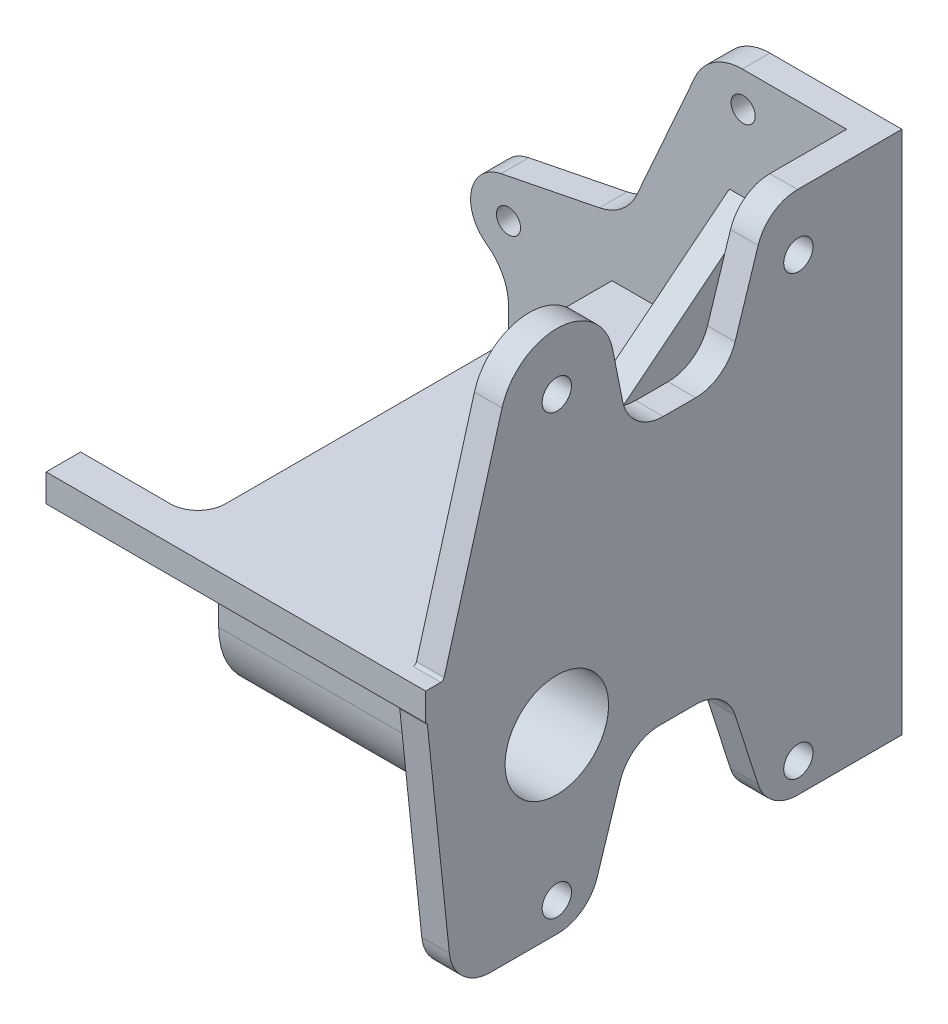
SolidWorks part; units mm, degrees
ref_plane "Plan1" through (0, 0, 0) normal (0, 0, 1) x (1, 0, 0)
ref_plane "Plan2" through (0, 0, 0) normal (0, 1, 0) x (1, 0, 0)
ref_plane "Plan3" through (0, 0, 0) normal (1, 0, 0) x (0, 0, -1)
sketch "Esquisse1" plane through (0, 0, 0) normal (0, 0, 1) x (1, 0, 0)
  line L0 (106, 72) -> (106, -80)
  line L1 (106, 72) -> (58, 72)
  line L2 (106, -80) -> (0, -80)
  line L3 (58, 72) -> (34, 18)
  line L4 (34, 18) -> (-2.1522, 10.7874)
  line L5 (0, -11) -> (0, -80)
  arc A0 (-2.1522, 10.7874) -> (0, -11) centre (0, 0) ccw
  dimension "D7" = 11
  dimension "D1" = 72
  dimension "D2" = 80
  dimension "D3" = 106
  dimension "D4" = 48
  dimension "D5" = 72
  dimension "D6" = 54
extrude "Base-Extrusion" add sketch "Esquisse1" along normal blind 8
fillet "Congé1" radius 15
sketch "Esquisse2" plane through (106, 0, 0) normal (1, 0, 0) x (0, 0, -1)
  line L0 (0, 72) -> (0, -80)
  line L1 (0, -80) -> (-39, -80)
  line L2 (0, 72) -> (-39, 72)
  line L3 (-39, 72) -> (-51, 34.5)
  line L4 (-39, -80) -> (-51, -42.5)
  line L5 (-138, -4) -> (0, -4) construction
  line L6 (-51, -42.5) -> (-79, -42.5)
  line L7 (-79, -42.5) -> (-91, -80)
  line L8 (-91, -80) -> (-130, -80)
  line L9 (-130, -80) -> (-138, -4)
  line L10 (-51, 34.5) -> (-79, 34.5)
  line L11 (-79, 34.5) -> (-83.817, 58.7187)
  line L12 (-115.8756, 59.9961) -> (-134, -4)
  line L13 (-138, -4) -> (-134, -4)
  arc A0 (-83.817, 58.7187) -> (-115.8756, 59.9961) centre (-100, 55.5) ccw
  dimension "D1" = 39
  dimension "D2" = 37.5
  dimension "D3" = 51
  dimension "D4" = 28
  dimension "D5" = 91
  dimension "D6" = 138
  dimension "D7" = 130
  dimension "D8" = 59.5
  dimension "D9" = 100
  dimension "D10" = 4
extrude "Boss.-Extru.1" add sketch "Esquisse2" against normal blind 8
fillet "Congé2" radius 12
sketch "Esquisse3" plane through (106, 0, 0) normal (1, 0, 0) x (0, 0, -1)
  line L0 (0, -80) -> (0, 72) construction
  line L1 (-138, 0) -> (0, 0)
  line L2 (-138, 0) -> (-138, -8)
  line L3 (-138, -8) -> (0, -8)
  line L4 (0, 0) -> (0, -8)
  dimension "D1" = 8
extrude "Boss.-Extru.2" add sketch "Esquisse3" against normal blind 76
fillet "Congé3" radius 1
sketch "Esquisse4" plane through (30, 0, 0) normal (-1, 0, 0) x (0, 0, 1)
  line L0 (138, -8) -> (8, -8) construction
  line L1 (138, 0) -> (128, 0)
  line L2 (138, 0) -> (138, -8)
  line L3 (138, -8) -> (128, -8)
  line L4 (128, 0) -> (128, -8)
  dimension "D1" = 10
extrude "Boss.-Extru.3" add sketch "Esquisse4" along normal blind 34
fillet "Congé4" radius 8
sketch "Esquisse5" plane through (30, 0, 0) normal (-1, 0, 0) x (0, 0, 1)
  line L0 (78, -8) -> (122, -8)
  line L1 (120, -8) -> (8, -8) construction
  line L2 (122, -8) -> (122, -30)
  line L3 (78, -30) -> (78, -8)
  line L4 (0, -21.2368) -> (0, -65) construction
  line L5 (8, 0) -> (120, 0) construction
  arc A0 (122, -30) -> (78, -30) centre (100, -30) cw
  dimension "D1" = 22
  dimension "D2" = 100
  dimension "D3" = 30
extrude "Boss.-Extru.4" add sketch "Esquisse5" along normal up to surface (68 mm away)
hole_wizard "Perçage1" positions "Esquisse7" profile "Esquisse6" legacy
sketch "Esquisse7" plane through (30, 0, 0) normal (-1, 0, 0) x (0, 0, 1)
  arc A0 (78, -30) -> (122, -30) centre (100, -30) ccw construction
  point P0 (100, -30)
sketch "Esquisse6" plane through (30, -30, 100) normal (0, 1, 0) x (0, 0, 1)
  line L0 (0, 0) -> (0, 76)
  line L1 (0, 76) -> (15, 76)
  line L2 (15, 76) -> (15, 0)
  line L3 (15, 0) -> (0, 0)
  line L4 (0, 110) -> (0, -10) construction
  dimension "Diamètre" = 30
  dimension "Profondeur" = 76
ref_plane "Plan4" through (68, 0, 0) normal (-1, 0, 0) x (0, 0, 1)
sketch "Esquisse8" plane through (68, 0, 0) normal (-1, 0, 0) x (0, 0, 1)
  line L0 (63, -4) -> (8, -48)
  line L1 (8, -48) -> (8, 40)
  line L2 (8, 40) -> (63, -4)
  line L3 (63, -4) -> (8, -4) construction
  line L4 (8, -8) -> (8, 0) construction
  dimension "D1" = 55
  dimension "D2" = 88
extrude "Boss.-Extru.5" add sketch "Esquisse8" along normal mid plane 8
hole_wizard "Perçage2" positions "Esquisse11" profile "Esquisse10"
sketch "Esquisse11" plane through (0, 0, 8) normal (0, 0, 1) x (1, 0, 0)
  point P0 (0, 0)
  point P1 (68, -62)
  point P2 (68, 62)
  dimension "D1" = 68
  dimension "D2" = 124
  dimension "D3" = 62
sketch "Esquisse10" plane through (0, 0, 8) normal (1, 0, 0) x (0, -1, 0)
  line L0 (0, 0) -> (0, 8)
  line L1 (0, 8) -> (3.5, 8)
  line L2 (3.5, 8) -> (3.5, 0)
  line L3 (3.5, 0) -> (0, 0)
  line L4 (0, 110) -> (0, -10) construction
  dimension "Diamètre" = 7
  dimension "Profondeur" = 8
hole_wizard "Perçage3" positions "Esquisse13" profile "Esquisse12"
sketch "Esquisse13" plane through (98, 0, 0) normal (-1, 0, 0) x (0, 0, 1)
  line L0 (8, 0) -> (8, 72) construction
  arc A0 (115.8756, 59.9961) -> (83.817, 58.7187) centre (100, 55.5) ccw construction
  point P0 (30, -71.5)
  point P1 (100, -71.5)
  point P2 (100, 55.5)
  point P3 (30, 55.5)
  dimension "D1" = 22
  dimension "D2" = 127
sketch "Esquisse12" plane through (98, -71.5, 30) normal (0, 1, 0) x (0, 0, 1)
  line L0 (0, 0) -> (0, 8)
  line L1 (0, 8) -> (4.25, 8)
  line L2 (4.25, 8) -> (4.25, 0)
  line L3 (4.25, 0) -> (0, 0)
  line L4 (0, 110) -> (0, -10) construction
  dimension "Diamètre" = 8.5
  dimension "Profondeur" = 8
